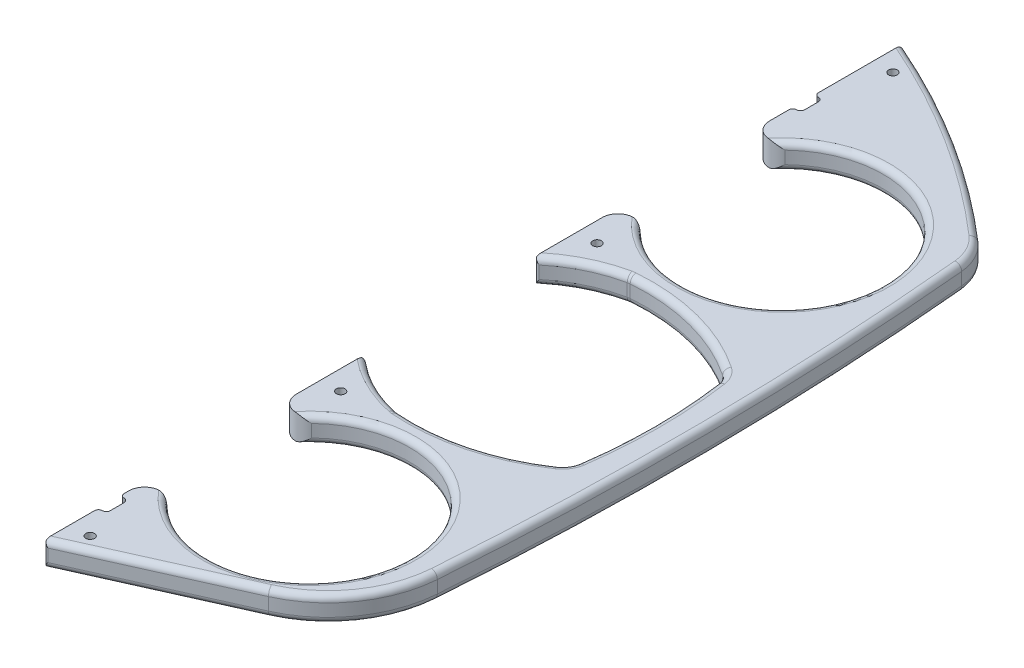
SolidWorks part; units mm, degrees
ref_plane "Front Plane" through (0, 0, 0) normal (0, 0, 1) x (1, 0, 0)
ref_plane "Top Plane" through (0, 0, 0) normal (0, 1, 0) x (1, 0, 0)
ref_plane "Right Plane" through (0, 0, 0) normal (1, 0, 0) x (0, 0, -1)
sketch "Sketch3" plane through (0, 0, 0) normal (0, 1, 0) x (1, 0, 0)
  line L4 (49, 336.0147) -> (49, 96.0147) construction
  line L5 (0, 216.0147) -> (118.4596, 216.0147) construction
  line L7 (0, 10.4817) -> (0, 53.5883)
  line L8 (0, 446.0147) -> (0, 378.4411)
  line L12 (0, 0) -> (0, -50) construction
  line L13 (0, 293.5883) -> (0, 138.4411)
  line L15 (0, -50) -> (-9.525, -50) construction
  line L16 (-9.525, -50) -> (-9.525, 6.2347) construction
  line L17 (-9.525, 6.2347) -> (-29.525, 6.2347) construction
  line L22 (-29.525, 6.2347) -> (-29.525, 2.2347) construction
  line L23 (49, 96.0147) -> (-2, 96.0147) construction
  line L24 (0, 10.4817) -> (78.6797, 45.7269)
  arc A0 (13.5593, 372.6883) -> (13.5593, 299.341) centre (49, 336.0147) cw
  arc A1 (13.5593, 132.6883) -> (13.5593, 59.341) centre (49, 96.0147) ccw construction
  arc A2 (113.9841, 336.0147) -> (113.9841, 96.0147) centre (-1492.5404, 216.0147) cw
  arc A3 (13.5593, 132.6883) -> (13.5593, 59.341) centre (49, 96.0147) cw
  arc A4 (-29.525, 2.2347) -> (-9.525, 6.2347) centre (-29.525, 54.2347) ccw construction
  arc A5 (113.9841, 336.0147) -> (111.6256, 364.2463) centre (-1492.5404, 216.0147) ccw
  arc A7 (102.9916, 381.0837) -> (0, 446.0147) centre (-159.3431, 79.1226) ccw
  arc A8 (102.9916, 381.0837) -> (111.6256, 364.2463) centre (86.3333, 361.9092) cw
  arc A9 (113.9841, 96.0147) -> (78.6797, 45.7269) centre (54.1508, 100.4839) cw
  arc A10 (0, 138.4411) -> (13.5593, 132.6883) centre (8, 138.4411) ccw
  arc A11 (0, 53.5883) -> (13.5593, 59.341) centre (8, 53.5883) cw
  arc A12 (13.5593, 59.341) -> (13.5593, 132.6883) centre (49, 96.0147) ccw construction
  arc A13 (13.5593, 299.341) -> (0, 293.5883) centre (8, 293.5883) ccw
  circle A14 centre (49, 96.0147) radius 48.55 construction
  arc A16 (0, 378.4411) -> (13.5593, 372.6883) centre (8, 378.4411) ccw
  point P0 (0, 216.0147)
  point P8 (49, 216.0147)
  point P13 (49, 96.0147)
  point P14 (49, 336.0147)
  dimension "D3" = 49
  dimension "D8" = 96.0147
  dimension "D16" = 20
  dimension "D17" = 52
  dimension "D4" = 435.533
  dimension "D7" = 102.9916
  dimension "D22" = 1611
  dimension "D23" = 60
  dimension "D25" = 97.1
  dimension "D26" = 51
  dimension "D27" = 240
  dimension "D19" = 25.4
  dimension "D11" = 400
  dimension "D6" = 8
  dimension "D5" = 50
  dimension "D13" = 9.525
  dimension "D14" = 89.78
  dimension "D15" = 4
  dimension "D18" = 10.4817
extrude "Boss-Extrude1" add sketch "Sketch3" along normal blind 12.7
sketch "Sketch10" plane through (0, 12.7, 0) normal (0, 1, 0) x (1, 0, 0)
  line L0 (0, 216.0147) -> (50000, 216.0147) construction
  line L4 (0, 258.5147) -> (0, 173.5147)
  line L5 (0, 293.5883) -> (0, 138.4411) construction
  arc A0 (13.5593, 299.341) -> (13.5593, 372.6883) centre (49, 336.0147) ccw construction
  arc A1 (113.9841, 96.0147) -> (111.6256, 364.2463) centre (-1492.5404, 216.0147) ccw construction
  arc A5 (0, 258.5147) -> (32.428, 274.657) centre (46.3459, 206.0546) cw
  arc A6 (32.428, 274.657) -> (100.3346, 255.4194) centre (40.878, 175.0147) cw
  arc A7 (100.3346, 255.4194) -> (100.3346, 176.61) centre (-146.5404, 216.0147) cw
  arc A9 (32.428, 157.3723) -> (100.3346, 176.61) centre (40.878, 257.0147) ccw
  arc A10 (0, 173.5147) -> (32.428, 157.3723) centre (46.3459, 225.9748) ccw
  point P36 (0, 216.0147)
  dimension "D1" = 85
  dimension "D2" = 70
  dimension "D3" = 100
  dimension "D4" = 15
  dimension "D5" = 250
  dimension "D6" = 10
  dimension "D7" = 58.6423
  dimension "D8" = 32.428
extrude "Cut-Extrude5" cut sketch "Sketch10" against normal through all
fillet "Fillet8" radius 10 4 edges at (32.428, 6.35, -157.3723) (32.428, 6.35, -274.657) (100.3346, 6.35, -176.61) (100.3346, 6.35, -255.4194)
sketch "Sketch13" plane through (0, 12.7, 0) normal (0, 1, 0) x (1, 0, 0)
  line L0 (103.4596, 216.0147) -> (50103.4596, 216.0147) construction
  line L1 (0, 293.5883) -> (0, 258.5147) construction
  circle A0 centre (10, 431.0147) radius 2.2
  circle A1 centre (10, 281.0147) radius 2.2
  circle A2 centre (10, 151.0147) radius 2.2
  circle A3 centre (10, 24.0147) radius 2.2
  arc A4 (100.9833, 180.9144) -> (100.9833, 251.1149) centre (-146.5404, 216.0147) ccw construction
  point P13 (103.4596, 216.0147)
  dimension "D1" = 4.4
  dimension "D2" = 65
  dimension "D3" = 65
  dimension "D4" = 10
  dimension "D5" = 215
  dimension "D6" = 192
extrude "Cut-Extrude6" cut sketch "Sketch13" against normal through all
sketch "Sketch14" plane through (0, 12.7, 0) normal (0, 1, 0) x (1, 0, 0)
  line L0 (0, 53.5883) -> (0, 10.4817) construction
  line L1 (0, 49.2183) -> (4, 49.2183)
  line L2 (0, 49.2183) -> (0, 38.2183)
  line L3 (0, 38.2183) -> (4, 38.2183)
  line L4 (4, 49.2183) -> (4, 38.2183)
  line L5 (0, 446.0147) -> (0, 378.4411) construction
  line L6 (0, 390.2111) -> (4, 390.2111)
  line L7 (0, 390.2111) -> (0, 401.2111)
  line L8 (0, 401.2111) -> (4, 401.2111)
  line L9 (4, 390.2111) -> (4, 401.2111)
  line L10 (0, 395.7111) -> (4, 395.7111) construction
  line L11 (0, 43.7183) -> (4, 43.7183) construction
  dimension "D1" = 9.87
  dimension "D2" = 11
  dimension "D3" = 4
  dimension "D4" = 17.27
extrude "Cut-Extrude7" cut sketch "Sketch14" against normal through all
fillet "Fillet9" radius 2 8 edges at (0, 6.35, -49.2183) (4, 6.35, -49.2183) (4, 6.35, -38.2183) (0, 6.35, -38.2183) (0, 6.35, -390.2111) (4, 6.35, -390.2111) (4, 6.35, -401.2111) (0, 6.35, -401.2111)
fillet "Fillet10" radius 1 4 edges at (0, 6.35, -446.0147) (0, 6.35, -10.4817) (0, 6.35, -173.5147) (0, 6.35, -258.5147)
fillet "Fillet12" radius 3.175 10 edges at (40.0443, 0, -28.4198) (103.2574, 0, -66.0087) (118.3973, 0, -230.1797) (108.935, 0, -373.499) (54.6273, 0, -417.0822) (40.0443, 12.7, -28.4198) (103.2574, 12.7, -66.0087) (118.3973, 12.7, -230.1797) (108.935, 12.7, -373.499) (54.6273, 12.7, -417.0822)
fillet "Fillet13" radius 3.175 18 edges at (15.8208, 0, -162.9809) (32.4228, 0, -157.3923) (66.2801, 0, -160.2948) (99.5552, 0, -177.007) (103.4596, 0, -216.0147) (99.5552, 0, -255.0223) (66.2801, 0, -271.7345) (32.4228, 0, -274.637) (15.8208, 0, -269.0484) (32.4228, 12.7, -157.3923) (15.8208, 12.7, -162.9809) (66.2801, 12.7, -160.2948) (99.5552, 12.7, -177.007) (15.8208, 12.7, -269.0484) (32.4228, 12.7, -274.637) (66.2801, 12.7, -271.7345) (99.5552, 12.7, -255.0223) (103.4596, 12.7, -216.0147)
fillet "Fillet15" radius 3.175 4 edges at (100, 12.7, -336.0147) (100, 12.7, -96.0147) (100, 0, -96.0147) (100, 0, -336.0147)
